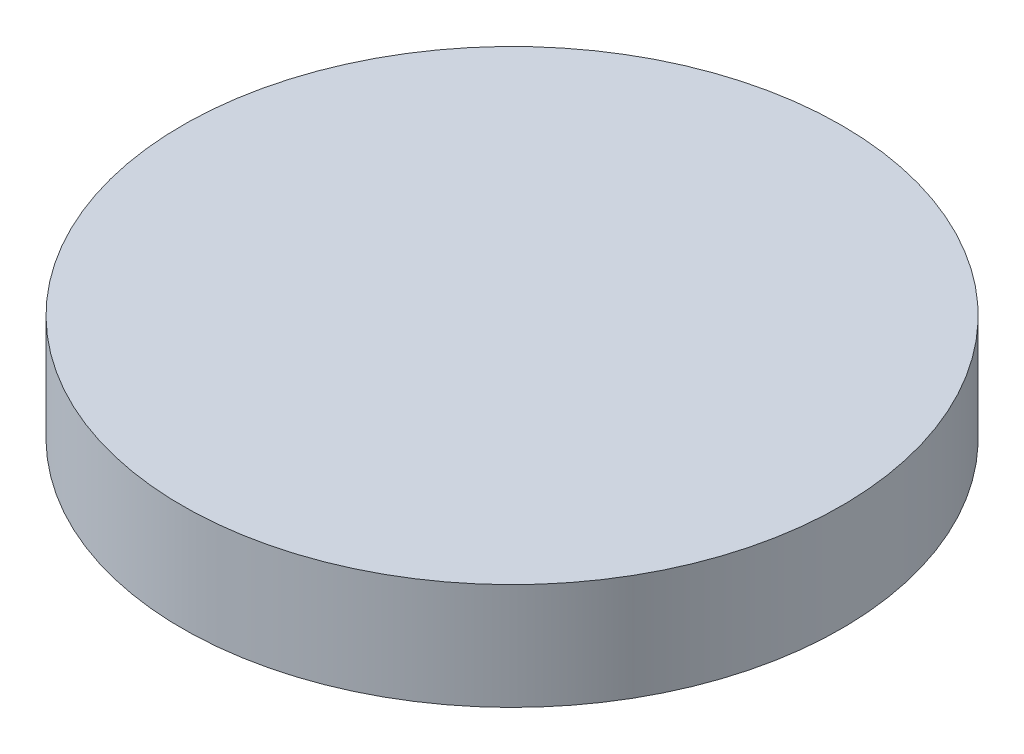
SolidWorks part; units mm, degrees
ref_plane "前视基准面" through (0, 0, 0) normal (0, 0, 1) x (1, 0, 0)
ref_plane "上视基准面" through (0, 0, 0) normal (0, 1, 0) x (1, 0, 0)
ref_plane "右视基准面" through (0, 0, 0) normal (1, 0, 0) x (0, 0, -1)
sketch "草图1" plane through (0, 0, 0) normal (0, 0, 1) x (1, 0, 0)
  line L0 (0, 0) -> (0, 528.9135) construction
  line L1 (0, 635) -> (1100, 635)
  line L2 (1100, 635) -> (1100, 280)
  line L3 (1100, 280) -> (625, 0)
  line L4 (625, 0) -> (0, 0)
  line L5 (0, 0) -> (0, 635)
  dimension "D1" = 355
  dimension "D2" = 280
  dimension "D3" = 2200
  dimension "D4" = 1250
revolve "旋转1" add sketch "草图1" angle 360 about L0
